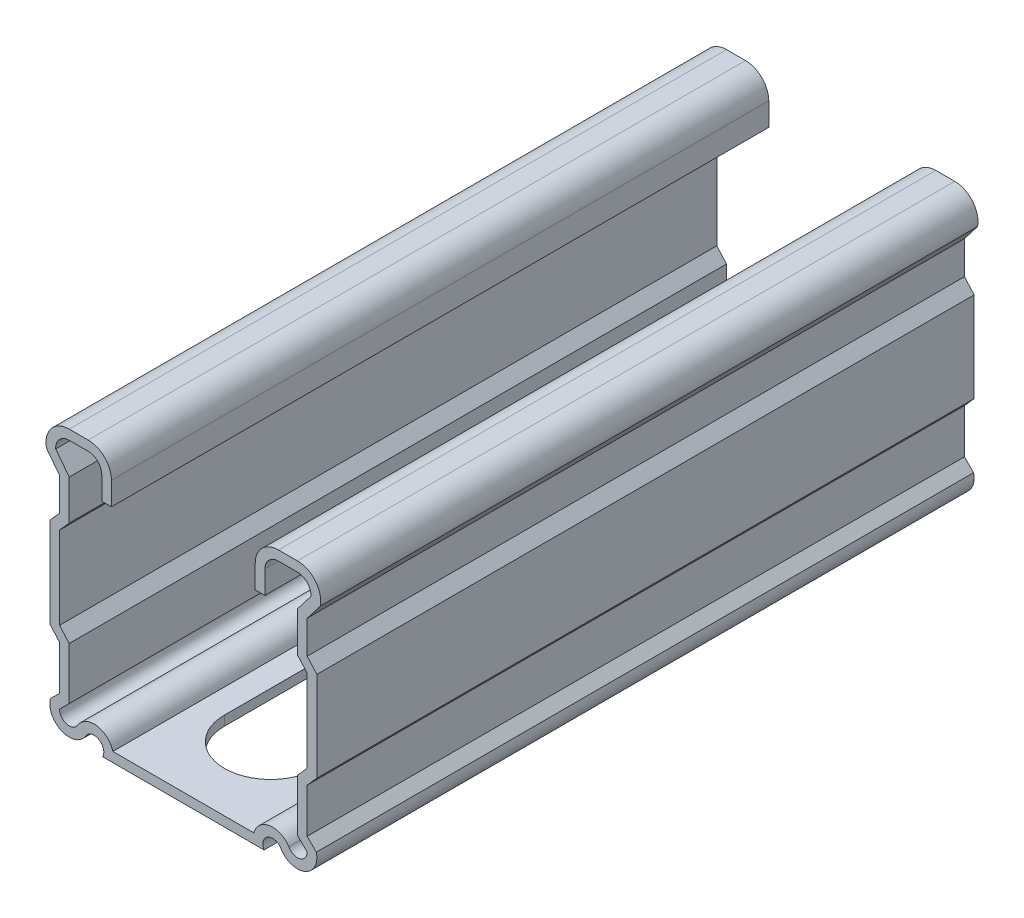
SolidWorks part; units mm, degrees
ref_plane "Plane1" through (0, 0, 0) normal (0, 0, 1) x (1, 0, 0)
ref_plane "Plane2" through (0, 0, 0) normal (0, 1, 0) x (1, 0, 0)
ref_plane "Plane3" through (0, 0, 0) normal (1, 0, 0) x (0, 0, -1)
other "Configuration Table"
sketch "Sketch1" plane through (0, 0, 0) normal (0, 0, 1) x (1, 0, 0)
  line L0 (17.6403, 16.3393) -> (19.7299, 19.0635)
  line L1 (17.6403, -13.9795) -> (19.1389, -15.4781)
  line L2 (-17.6403, -13.9795) -> (-19.1389, -15.4781)
  line L4 (-17.6403, -13.9795) -> (-17.6403, -5.9368)
  line L5 (17.6403, 21.2598) -> (14.7033, 21.2598)
  line L6 (12.6111, 19.1676) -> (12.6111, 15.6147)
  line L7 (-17.6403, -5.9368) -> (-19.1389, -4.2539)
  line L8 (-12.6111, 19.1676) -> (-12.6111, 15.6147)
  line L9 (0, 10.16) -> (0, -7.62) construction
  line L10 (-19.1389, -4.2539) -> (-19.1389, 8.4957)
  line L11 (-17.6403, 10.1786) -> (-19.1389, 8.4957)
  line L12 (-17.6403, 10.1786) -> (-17.6403, 16.3393)
  line L13 (-17.6403, 16.3393) -> (-19.7299, 19.0635)
  line L14 (-17.6403, 21.2598) -> (-14.7033, 21.2598)
  line L16 (17.6403, -13.9795) -> (17.6403, -5.9368)
  line L17 (17.6403, 10.1786) -> (17.6403, 16.3393)
  line L18 (-11.1125, 19.1676) -> (-11.1125, 15.6147)
  line L19 (-17.6403, 22.7584) -> (-14.7033, 22.7584)
  line L20 (-19.1389, 15.8307) -> (-21.1624, 18.4689)
  line L21 (-19.1389, 10.7491) -> (-19.1389, 15.8307)
  line L22 (-19.1389, 10.7491) -> (-20.6375, 9.0662)
  line L23 (-20.6375, -4.8244) -> (-20.6375, 9.0662)
  line L24 (-19.1389, -6.5073) -> (-20.6375, -4.8244)
  line L25 (19.1389, -4.2539) -> (19.1389, 8.4957)
  line L26 (-19.1389, -13.3588) -> (-19.1389, -6.5073)
  line L27 (-19.1389, -13.3588) -> (-20.5535, -14.7733)
  line L28 (11.1125, 19.1676) -> (11.1125, 15.6147)
  line L29 (17.6403, 22.7584) -> (14.7033, 22.7584)
  line L30 (19.1389, 15.8307) -> (21.1624, 18.4689)
  line L31 (19.1389, 10.7491) -> (19.1389, 15.8307)
  line L32 (19.1389, 10.7491) -> (20.6375, 9.0662)
  line L33 (20.6375, -4.8244) -> (20.6375, 9.0662)
  line L34 (19.1389, -6.5073) -> (20.6375, -4.8244)
  line L35 (19.1389, -13.3588) -> (19.1389, -6.5073)
  line L36 (19.1389, -13.3588) -> (20.5535, -14.7733)
  line L37 (17.6403, -5.9368) -> (19.1389, -4.2539)
  line L38 (-12.4806, -18.5166) -> (12.4806, -18.5166)
  line L39 (17.6403, 10.1786) -> (19.1389, 8.4957)
  line L41 (-10.899, -17.018) -> (10.899, -17.018)
  line L42 (-12.6111, 15.6147) -> (-11.1125, 15.6147)
  line L43 (11.1125, 15.6147) -> (12.6111, 15.6147)
  arc A0 (19.1389, -15.4781) -> (16.3052, -16.1588) centre (17.6403, -15.4781) cw
  arc A1 (16.3052, -16.1588) -> (10.899, -17.018) centre (13.7938, -17.7947) ccw
  arc A2 (-16.4143, -16.3399) -> (-10.899, -17.018) centre (-13.7938, -17.7947) cw
  arc A3 (-19.1389, -15.4781) -> (-16.4143, -16.3399) centre (-17.6403, -15.4781) ccw
  arc A4 (-17.6403, 21.2598) -> (-19.7299, 19.0635) centre (-17.6403, 19.1676) ccw
  arc A5 (-12.6111, 19.1676) -> (-14.7033, 21.2598) centre (-14.7033, 19.1676) ccw
  arc A6 (17.6403, 21.2598) -> (19.7299, 19.0635) centre (17.6403, 19.1676) cw
  arc A7 (12.6111, 19.1676) -> (14.7033, 21.2598) centre (14.7033, 19.1676) cw
  arc A8 (-11.1125, 19.1676) -> (-14.7033, 22.7584) centre (-14.7033, 19.1676) ccw
  arc A9 (-17.6403, 22.7584) -> (-21.1624, 18.4689) centre (-17.6403, 19.1676) ccw
  arc A10 (-20.5535, -14.7733) -> (-15.0198, -16.9329) centre (-17.6403, -15.4781) ccw
  arc A11 (11.1125, 19.1676) -> (14.7033, 22.7584) centre (14.7033, 19.1676) cw
  arc A12 (17.6403, 22.7584) -> (21.1624, 18.4689) centre (17.6403, 19.1676) cw
  arc A13 (20.5535, -14.7733) -> (15.0198, -16.9329) centre (17.6403, -15.4781) cw
  arc A14 (15.0198, -16.9329) -> (12.4806, -18.5166) centre (13.7938, -17.7947) ccw
  arc A15 (-15.0198, -16.9329) -> (-12.4806, -18.5166) centre (-13.7938, -17.7947) cw
  dimension "D9" = 7.1437
  dimension "base" = 18.5166
  dimension "D5" = 9.525
  dimension "ToeHt" = 22.7584
  dimension "D6" = 22.225
  dimension "D8" = 15.4781
  dimension "D12" = 41.275
  dimension "D14" = 13.6922
  dimension "D15" = 13.8906
extrude "Base-Extrude" add sketch "Sketch1" along normal blind 101.6
extrude "Slot" cut sketch "Sketch2" against normal through all
sketch "Sketch2" plane through (-0.0935, -18.5166, -16.4661) normal (0, -1, 0) x (1, 0, 0)
  line L0 (7.2372, 53.7723) -> (7.2372, 39.4848)
  line L1 (-7.0503, 39.4848) -> (-7.0503, 53.7723)
  arc A0 (-7.0503, 39.4848) -> (7.2372, 39.4848) centre (0.0935, 39.4848) ccw
  arc A1 (7.2372, 53.7723) -> (-7.0503, 53.7723) centre (0.0935, 53.7723) ccw
  dimension "D3" = 14.2875
  dimension "D1" = 23.0188
  dimension "D2" = 14.2875
pattern_linear "LPattern1" count 2 spacing 50.8 along (0, 0, 1) of "Slot"
equation "\"D1@LPattern1\" = \"D1@Base-Extrude\" / \"D3@LPattern1\""
